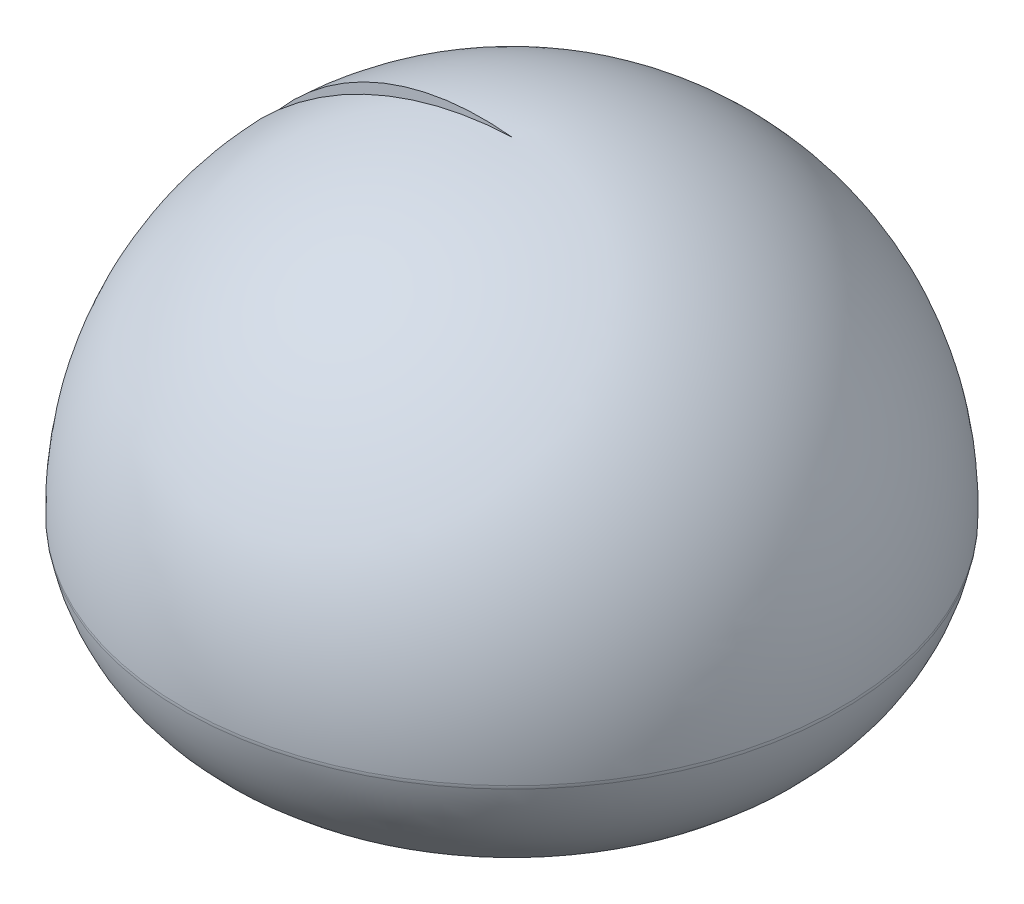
SolidWorks part; units mm, degrees
ref_plane "Ebene vorne" through (0, 0, 0) normal (0, 0, 1) x (1, 0, 0)
ref_plane "Ebene oben" through (0, 0, 0) normal (0, 1, 0) x (1, 0, 0)
ref_plane "Ebene rechts" through (0, 0, 0) normal (1, 0, 0) x (0, 0, -1)
sketch "Arbeitsraum_Konstruktionsskizze" plane through (0, 0, 0) normal (0, 0, 1) x (1, 0, 0)
  line L0 (25.05, 385) -> (426.97, 448.6579) construction
  line L1 (25.05, 385) -> (25.05, 791.93) construction
  line L2 (-80.2712, 778.0642) -> (-40.1674, 1210.37) construction
  line L3 (426.97, 448.6579) -> (529.7961, 26.8482) construction
  line L4 (25.05, 385) -> (0, 0) construction
  line L5 (25.05, 385) -> (-80.2712, 778.0642) construction
  line L6 (426.97, 448.6579) -> (227.8418, 62.854) construction
  line L7 (426.97, 448.6579) -> (852.7156, 363.5855) construction
  line L8 (-80.2712, 778.0642) -> (328.4795, 924.4181) construction
  line L9 (-80.2712, 778.0642) -> (324.2337, 620.3543) construction
  line L12 (852.7156, 363.5855) -> (902.7012, 349.2524) construction
  line L14 (-40.1674, 1210.37) -> (-31.1377, 1261.58) construction
  line L15 (-0.3331, 1176.9451) -> (-40.1674, 1210.37) construction
  line L16 (-89.0315, 1192.585) -> (-40.1674, 1210.37) construction
  line L17 (227.8418, 62.854) -> (200.286, 18.7555) construction
  line L18 (227.8418, 62.854) -> (279.8101, 61.0393) construction
  line L19 (227.8418, 62.854) -> (203.4293, 108.7673) construction
  line L20 (324.2337, 620.3543) -> (370.971, 597.559) construction
  line L21 (324.2337, 620.3543) -> (320.6064, 672.2276) construction
  line L22 (324.2337, 620.3543) -> (281.1237, 591.2763) construction
  line L23 (852.7156, 363.5855) -> (840.1357, 414.0409) construction
  line L24 (852.7156, 363.5855) -> (815.31, 327.4633) construction
  arc A1 (426.97, 448.6579) -> (-80.2712, 778.0642) centre (25.05, 385) ccw construction
  arc A4 (227.8418, 62.854) -> (852.7156, 363.5855) centre (426.97, 448.6579) ccw construction
  arc A5 (324.2337, 620.3543) -> (-40.1674, 1210.37) centre (-80.2712, 778.0642) ccw construction
  arc A6 (-0.3331, 1176.9451) -> (-89.0315, 1192.585) centre (-40.1674, 1210.37) ccw construction
  arc A7 (203.4293, 108.7673) -> (279.8101, 61.0393) centre (227.8418, 62.854) ccw construction
  arc A10 (815.31, 327.4633) -> (840.1357, 414.0409) centre (852.7156, 363.5855) ccw construction
  arc A14 (281.1237, 591.2763) -> (320.6064, 672.2276) centre (324.2337, 620.3543) ccw construction
  arc A15 (200.1395, 106.8607) -> (283.3638, 588.2038) centre (25.05, 385) ccw
  arc A18 (281.1237, 591.2763) -> (-0.3331, 1176.9451) centre (-80.2712, 778.0642) ccw
  arc A19 (281.1237, 591.2763) -> (-0.3331, 1176.9451) centre (-80.2712, 778.0642) ccw
  arc A20 (328.3725, 924.7167) -> (301.5795, 918.3713) centre (426.97, 448.6579) ccw
  arc A21 (203.992, 16.6459) -> (903.7076, 353.3963) centre (426.97, 448.6579) ccw
  arc A22 (904.6982, 362.2405) -> (-44.2635, 1262.2084) centre (25.05, 385) ccw
  arc A24 (310.075, 917.8284) -> (309.1695, 920.332) centre (-80.2712, 778.0642) ccw
  arc A25 (4.5912, 1183.8999) -> (-89.0315, 1192.585) centre (-80.2712, 778.0642) ccw
  text T0 "A1  " font "Century Gothic" height 20
  text T1 "A2" font "Century Gothic" height 20
  text T2 "A3" font "Century Gothic" height 20
  text T3 "A3" font "Century Gothic" height 20
  text T4 "A5" font "Century Gothic" height 20
  text T5 "A5" font "Century Gothic" height 20
  text T6 "A3" font "Century Gothic" height 20
  point P0 (25.05, 385)
  point P1 (25.05, 791.93)
  dimension "D3" = 94.7
  dimension "D6" = 434.162
  dimension "D7" = 65
  dimension "D10" = 434.162
  dimension "D11" = 175.3
  dimension "D14" = 104
  dimension "D18" = 104
  dimension "D19" = 104
  dimension "D20" = 104
  dimension "D1" = 81
  dimension "D2" = 15
  dimension "D4" = 41
  dimension "D5" = 65
  dimension "D8" = 94.7
  dimension "D9" = 41
  dimension "D12" = 120
  dimension "D13" = 120
  dimension "D15" = 175.3
  dimension "D16" = 120
  dimension "D17" = 120
  dimension "D21" = 120
  dimension "D22" = 120
  dimension "D23" = 120
  dimension "D24" = 120
  dimension "D25" = 175.3
sketch "Arbeitsraum" plane through (0, 0, 0) normal (0, 0, 1) x (1, 0, 0)
  arc A7 (281.1237, 591.2763) -> (320.6064, 672.2276) centre (324.2337, 620.3543) ccw construction
  arc A8 (200.1395, 106.8607) -> (283.3638, 588.2038) centre (25.05, 385) ccw construction
  arc A9 (203.4293, 108.7673) -> (279.8101, 61.0393) centre (227.8418, 62.854) ccw construction
  arc A10 (203.992, 16.6459) -> (903.7076, 353.3963) centre (426.97, 448.6579) ccw construction
  arc A11 (815.31, 327.4633) -> (840.1357, 414.0409) centre (852.7156, 363.5855) ccw construction
  arc A12 (904.6982, 362.2405) -> (-44.2635, 1262.2084) centre (25.05, 385) ccw construction
  arc A13 (281.1237, 591.2763) -> (-0.3331, 1176.9451) centre (-80.2712, 778.0642) ccw construction
  arc A14 (4.5912, 1183.8999) -> (-89.0315, 1192.585) centre (-80.2712, 778.0642) ccw construction
  arc A16 (-0.3331, 1176.9451) -> (-89.0315, 1192.585) centre (-40.1674, 1210.37) ccw construction
  arc A18 (281.1237, 591.2763) -> (283.3638, 588.2038) centre (324.2337, 620.3543) ccw
  arc A19 (200.1395, 106.8607) -> (283.3638, 588.2038) centre (25.05, 385) ccw
  arc A20 (200.1395, 106.8607) -> (203.992, 16.6459) centre (227.8418, 62.854) ccw
  arc A21 (203.992, 16.6459) -> (903.7076, 353.3963) centre (426.97, 448.6579) ccw
  arc A22 (903.7076, 353.3963) -> (904.6982, 362.2405) centre (852.7156, 363.5855) ccw
  arc A23 (904.6982, 362.2405) -> (-44.2635, 1262.2084) centre (25.05, 385) ccw
  arc A24 (281.1237, 591.2763) -> (-0.3331, 1176.9451) centre (-80.2712, 778.0642) ccw
  arc A25 (4.5912, 1183.8999) -> (-89.0315, 1192.585) centre (-80.2712, 778.0642) ccw
  arc A26 (-0.3331, 1176.9451) -> (4.5912, 1183.8999) centre (-40.1674, 1210.37) ccw
  arc A27 (-44.2635, 1262.2084) -> (-89.0315, 1192.585) centre (-40.1674, 1210.37) ccw
sketch "Aufsatz_rotiert" plane through (0, 0, 0) normal (0, 0, 1) x (1, 0, 0)
  line L0 (0, 1176.8782) -> (0, 1264.586)
  line L3 (0, 0) -> (0, -857.0058) construction
  arc A2 (904.6982, 362.2405) -> (-44.2635, 1262.2084) centre (25.05, 385) ccw construction
  arc A3 (815.31, 327.4633) -> (840.1357, 414.0409) centre (852.7156, 363.5855) ccw construction
  arc A18 (203.992, 16.6459) -> (903.7076, 353.3963) centre (426.97, 448.6579) ccw construction
  arc A19 (203.4293, 108.7673) -> (279.8101, 61.0393) centre (227.8418, 62.854) ccw construction
  arc A20 (281.1237, 591.2763) -> (320.6064, 672.2276) centre (324.2337, 620.3543) ccw construction
  arc A21 (200.1395, 106.8607) -> (283.3638, 588.2038) centre (25.05, 385) ccw construction
  arc A22 (281.1237, 591.2763) -> (-0.3331, 1176.9451) centre (-80.2712, 778.0642) ccw construction
  arc A23 (903.7076, 353.3963) -> (904.6982, 362.2405) centre (852.7156, 363.5855) ccw
  arc A24 (203.992, 16.6459) -> (903.7076, 353.3963) centre (426.97, 448.6579) ccw
  arc A25 (200.1395, 106.8607) -> (203.992, 16.6459) centre (227.8418, 62.854) ccw
  arc A26 (281.1237, 591.2763) -> (283.3638, 588.2038) centre (324.2337, 620.3543) ccw
  arc A27 (200.1395, 106.8607) -> (283.3638, 588.2038) centre (25.05, 385) ccw
  arc A28 (281.1237, 591.2763) -> (0, 1176.8782) centre (-80.2712, 778.0642) ccw
  arc A29 (904.6982, 362.2405) -> (0, 1264.586) centre (25.05, 385) ccw
revolve "Arbeitsraum_Kugel" add sketch "Aufsatz_rotiert" angle 176 about L3
